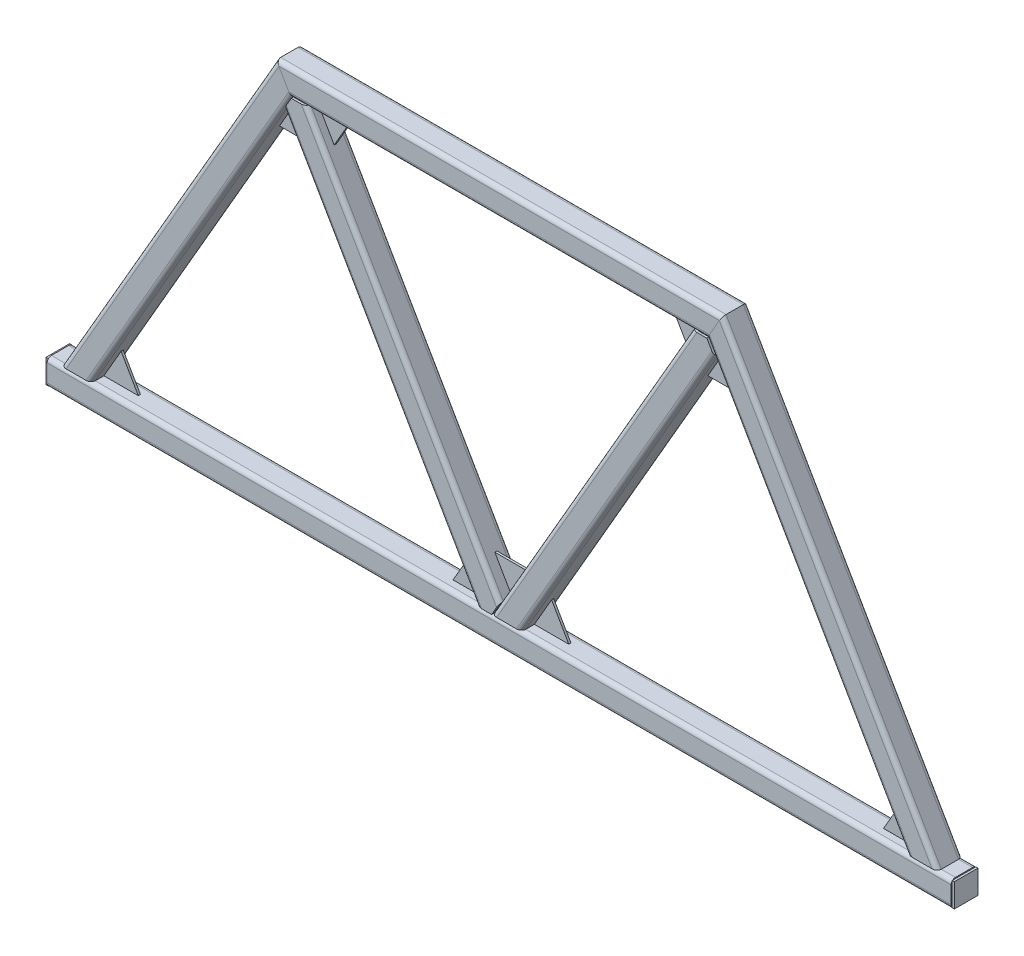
SolidWorks part; units mm, degrees
ref_plane "Front" through (0, 0, 0) normal (0, 0, 1) x (1, 0, 0)
ref_plane "Top" through (0, 0, 0) normal (0, 1, 0) x (1, 0, 0)
ref_plane "Right" through (0, 0, 0) normal (1, 0, 0) x (0, 0, -1)
sketch "Sketch1" plane through (0, 0, 0) normal (0, 0, 1) x (1, 0, 0)
  line L0 (0, 0) -> (2667, 0)
  dimension "D1" = 2667
sketch "Sketch113" plane through (0, 0, 0) normal (0, 0, 1) x (1, 0, 0)
  line L0 (63.5, 0) -> (698.5, 1099.8523)
  line L1 (698.5, 1099.8523) -> (1968.5, 1099.8523)
  line L2 (0, 0) -> (2667, 0) construction
  line L3 (1968.5, 1099.8523) -> (2603.5, 0)
  dimension "D1" = 1270
  dimension "D2" = 63.5
  dimension "D3" = 63.5
  dimension "D4" = 1270
  dimension "D5" = 1270
sketch "Sketch114" plane through (0, 0, 0) normal (0, 0, 1) x (1, 0, 0)
  line L0 (698.5, 1099.8523) -> (1333.5, 0)
  line L1 (0, 0) -> (2667, 0) construction
  line L2 (1333.5, 0) -> (1968.5, 1099.8523)
other "Structural Member10"
ref_plane "Plane12" through (0, 0, 0) normal (1, 0, 0) x (0, 0, -1)
sketch "Sketch116" plane through (0, 0, 0) normal (1, 0, 0) x (0, 0, -1)
  line L0 (-25.4, -31.75) -> (25.4, -31.75)
  line L1 (-31.75, -25.4) -> (-31.75, 25.4)
  line L2 (25.4, 31.75) -> (-25.4, 31.75)
  line L3 (31.75, 25.4) -> (31.75, -25.4)
  line L4 (-25.4, -38.1) -> (25.4, -38.1)
  line L5 (-38.1, -25.4) -> (-38.1, 25.4)
  line L6 (25.4, 38.1) -> (-25.4, 38.1)
  line L7 (38.1, 25.4) -> (38.1, -25.4)
  line L8 (0, 0) -> (31.75, 0) construction
  line L9 (0, 0) -> (0, 31.75) construction
  arc A0 (38.1, 25.4) -> (25.4, 38.1) centre (25.4, 25.4) ccw
  arc A1 (25.4, -38.1) -> (38.1, -25.4) centre (25.4, -25.4) ccw
  arc A2 (-38.1, -25.4) -> (-25.4, -38.1) centre (-25.4, -25.4) ccw
  arc A3 (-25.4, 38.1) -> (-38.1, 25.4) centre (-25.4, 25.4) ccw
  arc A4 (-25.4, 31.75) -> (-31.75, 25.4) centre (-25.4, 25.4) ccw
  arc A5 (31.75, 25.4) -> (25.4, 31.75) centre (25.4, 25.4) ccw
  arc A6 (25.4, -31.75) -> (31.75, -25.4) centre (25.4, -25.4) ccw
  arc A7 (-31.75, -25.4) -> (-25.4, -31.75) centre (-25.4, -25.4) ccw
  point P3 (0, 38.1)
  point P4 (38.1, 0)
  point P5 (0, -38.1)
  point P6 (-38.1, 0)
  point P7 (-38.1, 38.1)
  point P8 (-38.1, -38.1)
  point P33 (0, 0)
  point P35 (38.1, -38.1)
  point P36 (38.1, 38.1)
  point P37 (0, 0)
  dimension "D1" = 12.7
  dimension "Thickness" = 6.35
  dimension "V_leg" = 76.2
other "Structural Member11"
ref_plane "Plane13" through (1968.5, 1099.8523, 0) normal (0.5, -0.866, 0) x (0.866, 0.5, 0)
sketch "Sketch117" plane through (1968.5, 1099.8523, 0) normal (0.5, -0.866, 0) x (0.866, 0.5, 0)
  line L0 (-25.4, -31.75) -> (25.4, -31.75)
  line L1 (-31.75, -25.4) -> (-31.75, 25.4)
  line L2 (25.4, 31.75) -> (-25.4, 31.75)
  line L3 (31.75, 25.4) -> (31.75, -25.4)
  line L4 (-25.4, -38.1) -> (25.4, -38.1)
  line L5 (-38.1, -25.4) -> (-38.1, 25.4)
  line L6 (25.4, 38.1) -> (-25.4, 38.1)
  line L7 (38.1, 25.4) -> (38.1, -25.4)
  line L8 (0, 0) -> (31.75, 0) construction
  line L9 (0, 0) -> (0, 31.75) construction
  arc A0 (38.1, 25.4) -> (25.4, 38.1) centre (25.4, 25.4) ccw
  arc A1 (25.4, -38.1) -> (38.1, -25.4) centre (25.4, -25.4) ccw
  arc A2 (-38.1, -25.4) -> (-25.4, -38.1) centre (-25.4, -25.4) ccw
  arc A3 (-25.4, 38.1) -> (-38.1, 25.4) centre (-25.4, 25.4) ccw
  arc A4 (-25.4, 31.75) -> (-31.75, 25.4) centre (-25.4, 25.4) ccw
  arc A5 (31.75, 25.4) -> (25.4, 31.75) centre (25.4, 25.4) ccw
  arc A6 (25.4, -31.75) -> (31.75, -25.4) centre (25.4, -25.4) ccw
  arc A7 (-31.75, -25.4) -> (-25.4, -31.75) centre (-25.4, -25.4) ccw
  point P3 (0, 38.1)
  point P4 (38.1, 0)
  point P5 (0, -38.1)
  point P6 (-38.1, 0)
  point P7 (-38.1, 38.1)
  point P8 (-38.1, -38.1)
  point P33 (0, 0)
  point P35 (38.1, -38.1)
  point P36 (38.1, 38.1)
  point P37 (0, 0)
  dimension "D1" = 12.7
  dimension "Thickness" = 6.35
  dimension "V_leg" = 76.2
other "Structural Member14"
ref_plane "Plane16" through (1333.5, 0, 0) normal (0.5, 0.866, 0) x (-0.866, 0.5, 0)
sketch "Sketch120" plane through (1333.5, 0, 0) normal (0.5, 0.866, 0) x (-0.866, 0.5, 0)
  line L0 (-25.4, -31.75) -> (25.4, -31.75)
  line L1 (-31.75, -25.4) -> (-31.75, 25.4)
  line L2 (25.4, 31.75) -> (-25.4, 31.75)
  line L3 (31.75, 25.4) -> (31.75, -25.4)
  line L4 (-25.4, -38.1) -> (25.4, -38.1)
  line L5 (-38.1, -25.4) -> (-38.1, 25.4)
  line L6 (25.4, 38.1) -> (-25.4, 38.1)
  line L7 (38.1, 25.4) -> (38.1, -25.4)
  line L8 (0, 0) -> (31.75, 0) construction
  line L9 (0, 0) -> (0, 31.75) construction
  arc A0 (38.1, 25.4) -> (25.4, 38.1) centre (25.4, 25.4) ccw
  arc A1 (25.4, -38.1) -> (38.1, -25.4) centre (25.4, -25.4) ccw
  arc A2 (-38.1, -25.4) -> (-25.4, -38.1) centre (-25.4, -25.4) ccw
  arc A3 (-25.4, 38.1) -> (-38.1, 25.4) centre (-25.4, 25.4) ccw
  arc A4 (-25.4, 31.75) -> (-31.75, 25.4) centre (-25.4, 25.4) ccw
  arc A5 (31.75, 25.4) -> (25.4, 31.75) centre (25.4, 25.4) ccw
  arc A6 (25.4, -31.75) -> (31.75, -25.4) centre (25.4, -25.4) ccw
  arc A7 (-31.75, -25.4) -> (-25.4, -31.75) centre (-25.4, -25.4) ccw
  point P3 (0, 38.1)
  point P4 (38.1, 0)
  point P5 (0, -38.1)
  point P6 (-38.1, 0)
  point P7 (-38.1, 38.1)
  point P8 (-38.1, -38.1)
  point P33 (0, 0)
  point P35 (38.1, -38.1)
  point P36 (38.1, 38.1)
  point P37 (0, 0)
  dimension "D1" = 12.7
  dimension "Thickness" = 6.35
  dimension "V_leg" = 76.2
other "Trim/Extend7"
other "Trim/Extend8"
other "Trim/Extend11"
other "Trim/Extend12"
other "Trim/Extend13"
other "Trim/Extend14"
other "Gusset1" parameters "D1"=6.35, "D2"=6.35, "D3"=0, "D4"=0, "D10"=6.35, "D11"=101.6, "D12"=101.6, "D13"=12.7, "D14"=45, "D15"=12.7
sketch "Sketch121" plane through (764.4911, 1061.7523, 0) normal (0, 0, 1) x (1, 0, 0)
  line L0 (0, 0) -> (101.6, 0)
  line L1 (0, 0) -> (50.8, -87.9882)
  line L2 (101.6, 0) -> (50.8, -87.9882)
other "Gusset2" parameters "D1"=6.35, "D2"=6.35, "D3"=0, "D4"=0, "D10"=6.35, "D11"=101.6, "D12"=101.6, "D13"=12.7, "D14"=45, "D15"=12.7
sketch "Sketch122" plane through (698.5, 1023.6523, 0) normal (0, 0, -1) x (-1, 0, 0)
  line L0 (0, 0) -> (50.8, -87.9882)
  line L1 (0, 0) -> (-50.8, -87.9882)
  line L2 (50.8, -87.9882) -> (-50.8, -87.9882)
other "Gusset3" parameters "D1"=6.35, "D2"=6.35, "D3"=0, "D4"=0, "D10"=6.35, "D11"=101.6, "D12"=101.6, "D13"=12.7, "D14"=45, "D15"=12.7
sketch "Sketch123" plane through (1902.5089, 1061.7523, 0) normal (0, 0, -1) x (-1, 0, 0)
  line L0 (0, 0) -> (101.6, 0)
  line L1 (0, 0) -> (50.8, -87.9882)
  line L2 (101.6, 0) -> (50.8, -87.9882)
other "Gusset4" parameters "D1"=6.35, "D2"=6.35, "D3"=0, "D4"=0, "D10"=6.35, "D11"=101.6, "D12"=101.6, "D13"=12.7, "D14"=45, "D15"=12.7
sketch "Sketch124" plane through (1968.5, 1023.6523, 0) normal (0, 0, 1) x (1, 0, 0)
  line L0 (0, 0) -> (-50.8, -87.9882)
  line L1 (0, 0) -> (50.8, -87.9882)
  line L2 (-50.8, -87.9882) -> (50.8, -87.9882)
other "Gusset5" parameters "D1"=6.35, "D2"=6.35, "D3"=0, "D4"=0, "D10"=6.35, "D11"=101.6, "D12"=101.6, "D13"=12.7, "D14"=45, "D15"=12.7
sketch "Sketch125" plane through (1267.5089, 38.1, 0) normal (0, 0, 1) x (1, 0, 0)
  line L0 (0, 0) -> (-50.8, 87.9882)
  line L1 (0, 0) -> (-101.6, 0)
  line L2 (-50.8, 87.9882) -> (-101.6, 0)
other "Gusset6" parameters "D1"=6.35, "D2"=6.35, "D3"=0, "D4"=0, "D10"=6.35, "D11"=101.6, "D12"=101.6, "D13"=12.7, "D14"=45, "D15"=12.7
sketch "Sketch126" plane through (1399.4911, 38.1, 0) normal (0, 0, -1) x (-1, 0, 0)
  line L0 (0, 0) -> (-50.8, 87.9882)
  line L1 (0, 0) -> (-101.6, 0)
  line L2 (-50.8, 87.9882) -> (-101.6, 0)
other "Gusset7" parameters "D1"=6.35, "D2"=6.35, "D3"=0, "D4"=0, "D10"=6.35, "D11"=101.6, "D12"=101.6, "D13"=12.7, "D14"=45, "D15"=12.7
sketch "Sketch127" plane through (129.4911, 38.1, 0) normal (0, 0, -1) x (-1, 0, 0)
  line L0 (0, 0) -> (-50.8, 87.9882)
  line L1 (0, 0) -> (-101.6, 0)
  line L2 (-50.8, 87.9882) -> (-101.6, 0)
other "Gusset8" parameters "D1"=6.35, "D2"=6.35, "D3"=0, "D4"=0, "D10"=6.35, "D11"=101.6, "D12"=101.6, "D13"=12.7, "D14"=45, "D15"=12.7
sketch "Sketch128" plane through (2537.5089, 38.1, 0) normal (0, 0, 1) x (1, 0, 0)
  line L0 (0, 0) -> (-101.6, 0)
  line L1 (0, 0) -> (-50.8, 87.9882)
  line L2 (-101.6, 0) -> (-50.8, 87.9882)
other "Gusset9" parameters "D1"=6.35, "D2"=6.35, "D3"=0, "D4"=0, "D10"=6.35, "D11"=101.6, "D12"=101.6, "D13"=12.7, "D14"=45, "D15"=12.7
sketch "Sketch129" plane through (1333.5, 76.2, 0) normal (0, 0, -1) x (-1, 0, 0)
  line L0 (0, 0) -> (-50.8, 87.9882)
  line L1 (0, 0) -> (50.8, 87.9882)
  line L2 (-50.8, 87.9882) -> (50.8, 87.9882)
other "End cap1" parameters "D1"=6.35, "D2"=3.175, "D3"=3.175
other "End cap2" parameters "D1"=6.35, "D2"=3.175, "D3"=3.175
